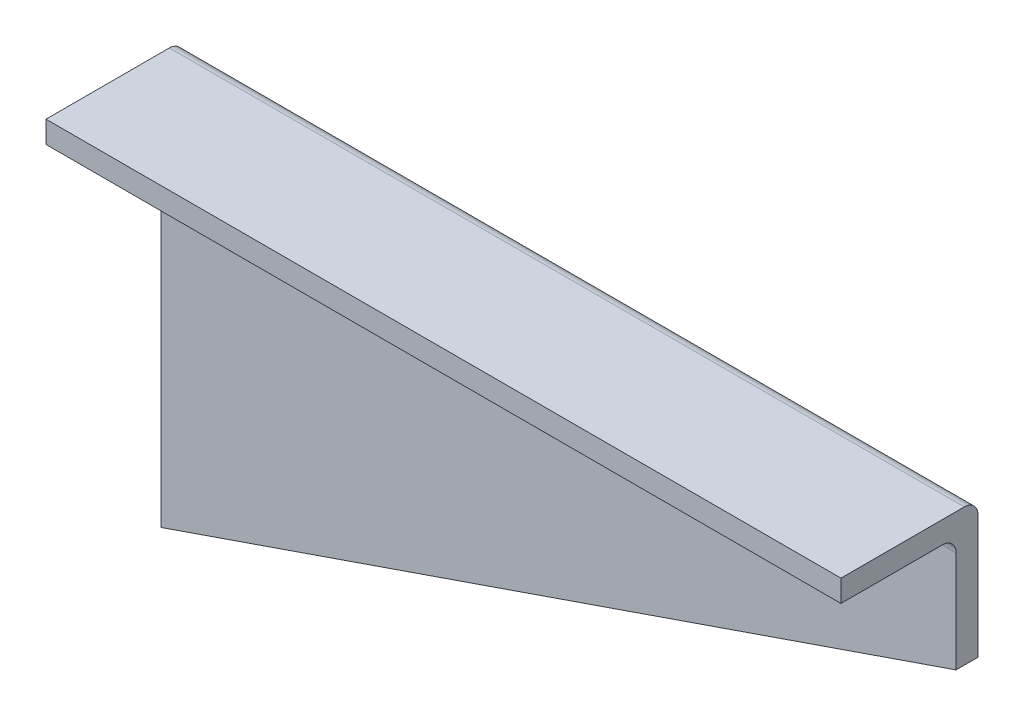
SolidWorks part; units mm, degrees
ref_plane "前视基准面" through (0, 0, 0) normal (0, 0, 1) x (1, 0, 0)
ref_plane "上视基准面" through (0, 0, 0) normal (0, 1, 0) x (1, 0, 0)
ref_plane "右视基准面" through (0, 0, 0) normal (1, 0, 0) x (0, 0, -1)
sketch "草图1" plane through (0, 0, 0) normal (0, 0, 1) x (1, 0, 0)
  line L0 (0, 0) -> (0, -150)
  line L1 (0, -150) -> (290, -50)
  line L2 (290, -50) -> (290, 0)
  line L3 (290, 0) -> (0, 0)
  dimension "D1" = 150
  dimension "D2" = 50
  dimension "D3" = 290
extrude "拉伸1" add sketch "草图1" along normal blind 8
sketch "草图2" plane through (0, 0, 8) normal (0, 0, 1) x (1, 0, 0)
  line L0 (290, -50) -> (290, 0) construction
  line L1 (0, 0) -> (290, 0)
  line L2 (0, 0) -> (0, -8)
  line L3 (0, -8) -> (290, -8)
  line L4 (290, 0) -> (290, -8)
  dimension "D1" = 8
extrude "拉伸2" add sketch "草图2" along normal blind 42
sketch "草图3" plane through (0, 0, 8) normal (0, 0, 1) x (1, 0, 0)
  line L1 (290, -50) -> (290, -8) construction
  line L3 (290, 0) -> (0, 0) construction
  circle A0 centre (250, -30) radius 6.5
  circle A1 centre (180, -30) radius 6.5
  dimension "D1" = 30
  dimension "D2" = 40
  dimension "D3" = 70
  dimension "D4" = 13
  dimension "D5" = 13
extrude "切除-拉伸1" cut sketch "草图3" against normal blind 42
fillet "圆角1" radius 5 2 edges at (145, 0, 0)
